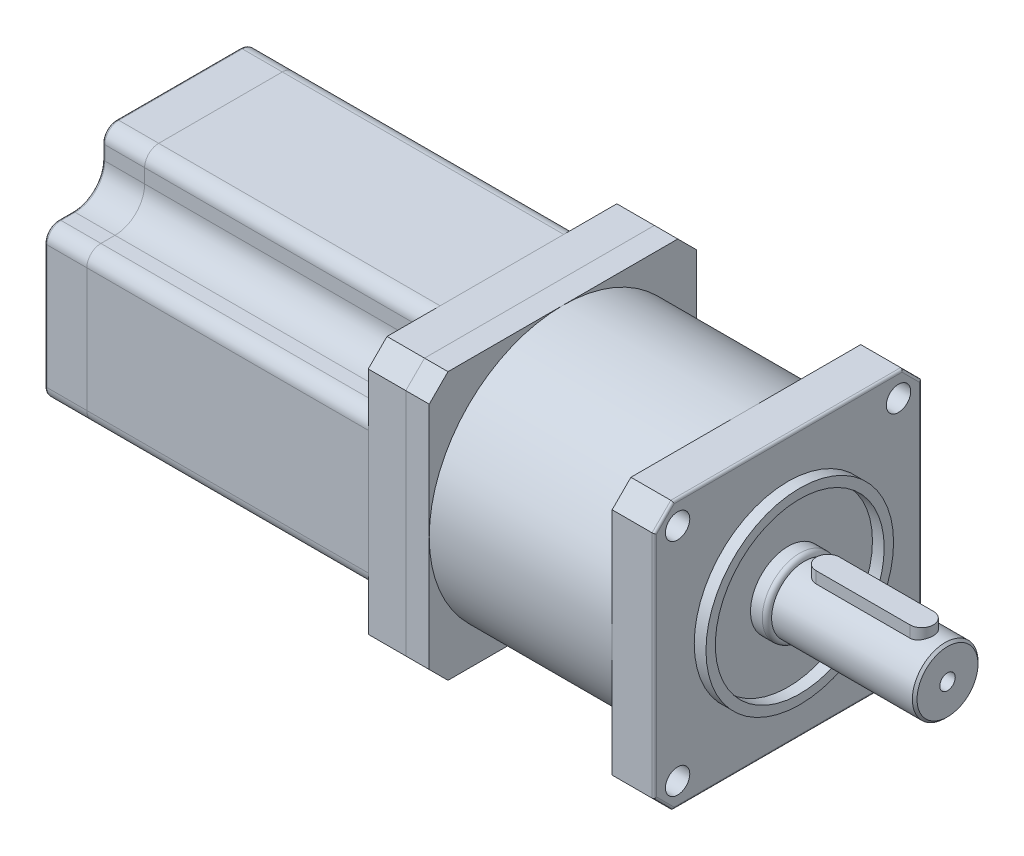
SolidWorks part; units mm, degrees
ref_plane "前视基准面" through (0, 0, 0) normal (0, 0, 1) x (1, 0, 0)
ref_plane "上视基准面" through (0, 0, 0) normal (0, 1, 0) x (1, 0, 0)
ref_plane "右视基准面" through (0, 0, 0) normal (1, 0, 0) x (0, 0, -1)
sketch "草图1" plane through (0, 0, 0) normal (1, 0, 0) x (0, 0, -1)
  line L0 (-28.5, 24.5) -> (-24.5, 28.5)
  line L1 (-24.5, -28.5) -> (24.5, -28.5)
  line L2 (-28.5, -24.5) -> (-28.5, 24.5)
  line L3 (-24.5, 28.5) -> (24.5, 28.5)
  line L4 (28.5, -24.5) -> (28.5, 24.5)
  line L5 (-28.5, -28.5) -> (28.5, 28.5) construction
  line L6 (-28.5, 28.5) -> (28.5, -28.5) construction
  line L7 (24.5, 28.5) -> (28.5, 24.5)
  line L8 (24.5, -28.5) -> (28.5, -24.5)
  line L9 (-28.5, -24.5) -> (-24.5, -28.5)
  point P0 (0, 0)
extrude "凸台-拉伸1" add sketch "草图1" against normal blind 9
sketch "草图2" plane through (-9, 0, 0) normal (-1, 0, 0) x (0, 0, 1)
  circle A0 centre (0, 0) radius 28.5
extrude "凸台-拉伸2" add sketch "草图2" along normal blind 39
sketch "草图3" plane through (-48, 0, 0) normal (-1, 0, 0) x (0, 0, 1)
  line L0 (0, 28.5) -> (24.5, 28.5) construction
  line L1 (-24.5, -28.5) -> (24.5, -28.5)
  line L2 (-28.5, -24.5) -> (-28.5, 24.5)
  line L3 (-24.5, 28.5) -> (24.5, 28.5)
  line L4 (28.5, -24.5) -> (28.5, 24.5)
  line L5 (-28.5, -28.5) -> (28.5, 28.5) construction
  line L6 (-28.5, 28.5) -> (28.5, -28.5) construction
  line L7 (-28.5, 24.5) -> (-24.5, 28.5)
  line L8 (24.5, 28.5) -> (28.5, 24.5)
  line L9 (24.5, -28.5) -> (28.5, -24.5)
  line L10 (-28.5, -24.5) -> (-24.5, -28.5)
  point P0 (0, 0)
extrude "凸台-拉伸3" add sketch "草图3" along normal blind 5
sketch "草图4" plane through (-53, 0, 0) normal (-1, 0, 0) x (0, 0, 1)
  line L0 (24.5, 28.5) -> (-24.5, 28.5) construction
  line L1 (-24.5, -28.5) -> (24.5, -28.5)
  line L2 (-28.5, -24.5) -> (-28.5, 24.5)
  line L3 (-24.5, 28.5) -> (24.5, 28.5)
  line L4 (28.5, -24.5) -> (28.5, 24.5)
  line L5 (-28.5, -28.5) -> (28.5, 28.5) construction
  line L6 (-28.5, 28.5) -> (28.5, -28.5) construction
  line L7 (-28.5, 24.5) -> (-24.5, 28.5)
  line L8 (24.5, 28.5) -> (28.5, 24.5)
  line L9 (24.5, -28.5) -> (28.5, -24.5)
  line L10 (-28.5, -24.5) -> (-24.5, -28.5)
  point P0 (0, 0)
extrude "凸台-拉伸4" add sketch "草图4" along normal blind 8 separate body
sketch "草图5" plane through (-61, 0, 0) normal (-1, 0, 0) x (0, 0, 1)
  line L0 (24.5, 28.5) -> (-24.5, 28.5) construction
  line L1 (-24.5, -28.5) -> (24.5, -28.5)
  line L2 (-28.5, -24.5) -> (-28.5, 24.5)
  line L3 (-24.5, 28.5) -> (24.5, 28.5)
  line L4 (28.5, -24.5) -> (28.5, 24.5)
  line L5 (-28.5, -28.5) -> (28.5, 28.5) construction
  line L6 (-28.5, 28.5) -> (28.5, -28.5) construction
  line L7 (-28.5, 24.5) -> (-24.5, 28.5)
  line L8 (-24.5, -28.5) -> (-28.5, -24.5)
  line L9 (24.5, -28.5) -> (28.5, -24.5)
  line L10 (28.5, 24.5) -> (24.5, 28.5)
  point P0 (0, 0)
extrude "凸台-拉伸5" add sketch "草图5" along normal blind 60 separate body
sketch "草图6" plane through (-121, 0, 0) normal (-1, 0, 0) x (0, 0, 1)
  line L0 (24.5, 28.5) -> (-24.5, 28.5) construction
  line L1 (-24.5, -28.5) -> (24.5, -28.5)
  line L2 (-28.5, -24.5) -> (-28.5, 24.5)
  line L3 (-24.5, 28.5) -> (24.5, 28.5)
  line L4 (28.5, -24.5) -> (28.5, 24.5)
  line L5 (-28.5, -28.5) -> (28.5, 28.5) construction
  line L6 (-28.5, 28.5) -> (28.5, -28.5) construction
  line L7 (-28.5, 24.5) -> (-24.5, 28.5)
  line L8 (-24.5, -28.5) -> (-28.5, -24.5)
  line L9 (24.5, -28.5) -> (28.5, -24.5)
  line L10 (28.5, 24.5) -> (24.5, 28.5)
  point P0 (0, 0)
extrude "凸台-拉伸6" add sketch "草图6" along normal blind 9 separate body
sketch "草图7" plane through (-130, 0, 0) normal (-1, 0, 0) x (0, 0, 1)
  line L0 (-22.5, 16.1754) -> (-25.5, 16.1754)
  line L1 (-28.5, 13.1754) -> (-28.5, 24.5)
  line L2 (-28.5, 24.5) -> (-24.5, 28.5)
  line L3 (-24.5, 28.5) -> (-13.1754, 28.5)
  line L4 (13.1754, 28.5) -> (24.5, 28.5)
  line L5 (24.5, 28.5) -> (28.5, 24.5)
  line L6 (28.5, 24.5) -> (28.5, 13.1754)
  line L7 (-28.5, 24.5) -> (-28.5, -24.5) construction
  line L9 (-25.5, -16.1754) -> (-22.5, -16.1754)
  line L10 (28.5, -13.1754) -> (28.5, -24.5)
  line L11 (-16.1754, -22.5) -> (-16.1754, -25.5)
  line L12 (-24.5, -28.5) -> (24.5, -28.5) construction
  line L14 (16.1754, -25.5) -> (16.1754, -22.5)
  line L15 (28.5, -24.5) -> (24.5, -28.5)
  line L16 (22.5, -16.1754) -> (25.5, -16.1754)
  line L17 (28.5, -24.5) -> (28.5, 24.5) construction
  line L19 (25.5, 16.1754) -> (22.5, 16.1754)
  line L20 (24.5, -28.5) -> (13.1754, -28.5)
  line L21 (16.1754, 22.5) -> (16.1754, 25.5)
  line L22 (24.5, 28.5) -> (-24.5, 28.5) construction
  line L24 (-16.1754, 25.5) -> (-16.1754, 22.5)
  line L25 (-13.1754, -28.5) -> (-24.5, -28.5)
  line L26 (-24.5, -28.5) -> (-28.5, -24.5)
  line L27 (-28.5, -24.5) -> (-28.5, -13.1754)
  arc A0 (-22.5, 16.1754) -> (-16.1754, 22.5) centre (-22.5, 22.5) ccw
  arc A1 (16.1754, 22.5) -> (22.5, 16.1754) centre (22.5, 22.5) ccw
  arc A2 (22.5, -16.1754) -> (16.1754, -22.5) centre (22.5, -22.5) ccw
  arc A3 (-16.1754, -22.5) -> (-22.5, -16.1754) centre (-22.5, -22.5) ccw
  arc A4 (-13.1754, 28.5) -> (-16.1754, 25.5) centre (-13.1754, 25.5) ccw
  arc A5 (16.1754, 25.5) -> (13.1754, 28.5) centre (13.1754, 25.5) ccw
  arc A6 (28.5, 13.1754) -> (25.5, 16.1754) centre (25.5, 13.1754) ccw
  arc A7 (25.5, -16.1754) -> (28.5, -13.1754) centre (25.5, -13.1754) ccw
  arc A8 (13.1754, -28.5) -> (16.1754, -25.5) centre (13.1754, -25.5) ccw
  arc A9 (-16.1754, -25.5) -> (-13.1754, -28.5) centre (-13.1754, -25.5) ccw
  arc A10 (-28.5, -13.1754) -> (-25.5, -16.1754) centre (-25.5, -13.1754) ccw
  arc A11 (-25.5, 16.1754) -> (-28.5, 13.1754) centre (-25.5, 13.1754) ccw
  point P0 (0, 0)
  point P10 (-16.1754, 28.5)
  point P39 (16.1754, 28.5)
  point P42 (28.5, 16.1754)
  point P45 (28.5, -16.1754)
  point P48 (16.1754, -28.5)
  point P51 (-16.1754, -28.5)
  point P54 (-28.5, -16.1754)
  point P57 (-28.5, 16.1754)
  dimension "D1" = 3
extrude "切除-拉伸1" cut sketch "草图7" against normal blind 69
fillet "圆角1" radius 0.5 24 edges at (-130, 28.5, 0) (-130, 27.6213, 15.2968) (-130, 24, 16.1754) (-130, 18.0279, 18.0279) (-130, 16.1754, 24) (-130, 15.2968, 27.6213) (-130, 0, 28.5) (-130, -15.2968, 27.6213) (-130, -16.1754, 24) (-130, -18.0279, 18.0279) (-130, -24, 16.1754) (-130, -27.6213, 15.2968) (-130, -28.5, 0) (-130, -27.6213, -15.2968) (-130, -24, -16.1754) (-130, -18.0279, -18.0279) (-130, -16.1754, -24) (-130, -15.2968, -27.6213) (-130, 0, -28.5) (-130, 15.2968, -27.6213) (-130, 16.1754, -24) (-130, 18.0279, -18.0279) (-130, 24, -16.1754) (-130, 27.6213, -15.2968)
fillet "圆角2" radius 0.5 8 edges at (0, 26.5, -26.5) (0, 0, -28.5) (0, -26.5, -26.5) (0, -28.5, 0) (0, -26.5, 26.5) (0, 0, 28.5) (0, 26.5, 26.5) (0, 28.5, 0)
sketch "草图8" plane through (0, 0, 0) normal (1, 0, 0) x (0, 0, -1)
  circle A0 centre (-23.55, 23.55) radius 2.6
  circle A1 centre (23.55, 23.55) radius 2.6
  circle A2 centre (23.55, -23.55) radius 2.6
  circle A3 centre (-23.55, -23.55) radius 2.6
  point P0 (0, 0)
extrude "切除-拉伸2" cut sketch "草图8" against normal blind 9
sketch "草图9" plane through (0, 0, 0) normal (1, 0, 0) x (0, 0, -1)
  circle A0 centre (0, 0) radius 20
  circle A1 centre (0, 0) radius 18
extrude "凸台-拉伸7" add sketch "草图9" along normal blind 2.5
sketch "草图10" plane through (0, 0, 0) normal (1, 0, 0) x (0, 0, -1)
  circle A0 centre (0, 0) radius 8
extrude "凸台-拉伸8" add sketch "草图10" along normal blind 3.5
fillet "圆角3" radius 1 1 edges at (3.5, 0, -8)
sketch "草图11" plane through (3.5, 0, 0) normal (1, 0, 0) x (0, 0, -1)
  circle A0 centre (0, 0) radius 7
extrude "凸台-拉伸9" add sketch "草图11" along normal blind 30.5 separate body
ref_plane "基准面1" through (0, 7, 0) normal (0, 1, 0) x (1, 0, 0)
sketch "草图12" plane through (0, 7, 0) normal (0, 1, 0) x (1, 0, 0)
  line L4 (8.5, 2.5) -> (28.5, 2.5)
  line L6 (28.5, -2.5) -> (8.5, -2.5)
  arc A0 (28.5, -2.5) -> (28.5, 2.5) centre (28.5, 0) ccw
  arc A1 (8.5, 2.5) -> (8.5, -2.5) centre (8.5, 0) ccw
extrude "切除-拉伸3" cut sketch "草图12" against normal blind 3
sketch "草图13" plane through (0, 4, 0) normal (0, 1, 0) x (1, 0, 0)
  line L0 (28.5, 2.5) -> (8.5, 2.5)
  line L2 (8.5, -2.5) -> (28.5, -2.5)
  arc A0 (8.5, 2.5) -> (8.5, -2.5) centre (8.5, 0) ccw
  arc A1 (28.5, -2.5) -> (28.5, 2.5) centre (28.5, 0) ccw
extrude "凸台-拉伸10" add sketch "草图13" along normal blind 5 separate body
chamfer "倒角1" distance 0.5 angle 45 1 edges at (34, 0, -7)
sketch "草图14" plane through (34, 0, 0) normal (1, 0, 0) x (0, 0, -1)
  point P0 (0, 0)
hole_wizard "M4 螺纹孔1" positions "3D草图3" profile "草图16" tap size "M4" standard "GB"
sketch3d "3D草图3"
  point P0 (34, 0, 0)
sketch "草图16" plane through (34, 0, 0) normal (0, 1, 0) x (0, 0, -1)
  line L0 (0, 0) -> (0, 10.4914)
  line L1 (0, 10.4914) -> (1.65, 9.5)
  line L2 (1.65, 9.5) -> (1.65, 0)
  line L5 (1.65, 0) -> (0, 0)
  line L10 (0, 10.4914) -> (-1.65, 9.5) construction
  line L11 (0, -6.35) -> (0, 107.95) construction
  dimension "螺纹孔钻头直径" = 3.3
  dimension "螺纹孔钻头深度" = 9.5
  dimension "导头角度" = 118
